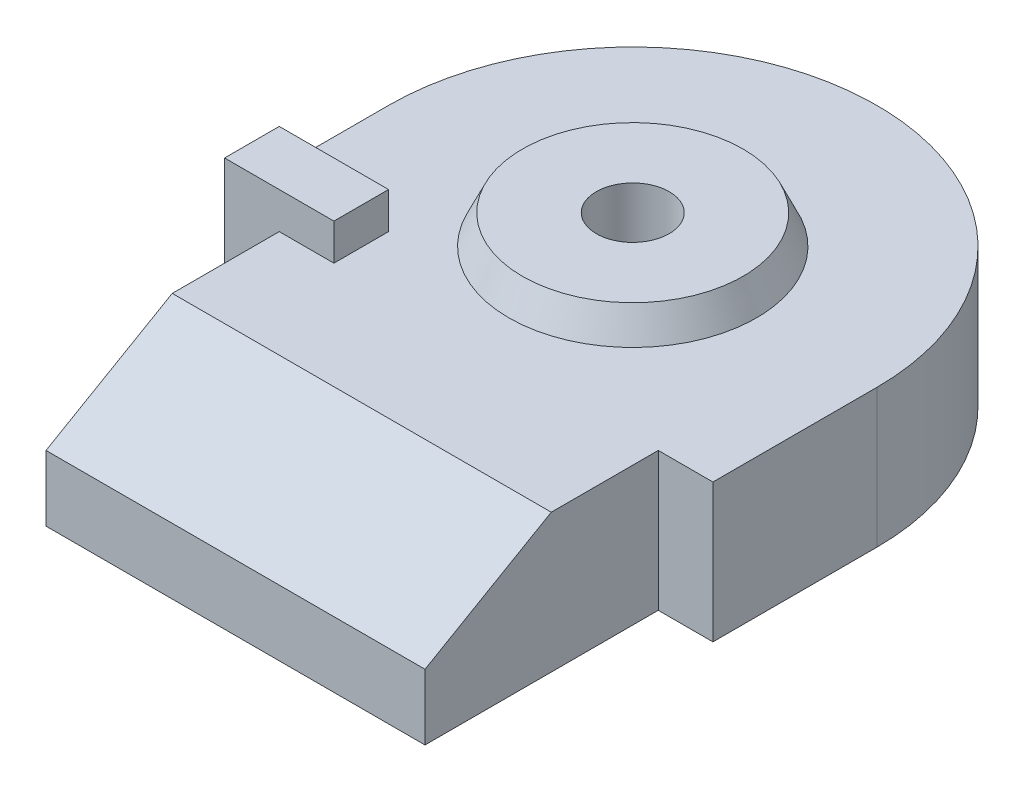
SolidWorks part; units mm, degrees
ref_plane "Front Plane" through (0, 0, 0) normal (0, 0, 1) x (1, 0, 0)
ref_plane "Top Plane" through (0, 0, 0) normal (0, 1, 0) x (1, 0, 0)
ref_plane "Right Plane" through (0, 0, 0) normal (1, 0, 0) x (0, 0, -1)
sketch "Sketch1" plane through (0, 0, 0) normal (0, 1, 0) x (1, 0, 0)
  line L0 (0, 335) -> (0, -545) construction
  line L1 (335, 0) -> (-335, 0) construction
  line L2 (-335, 0) -> (-335, -225)
  line L3 (-335, -225) -> (-260, -225)
  line L4 (-260, -225) -> (-260, -545)
  line L5 (-260, -545) -> (260, -545)
  line L6 (260, -225) -> (260, -545)
  line L7 (335, -225) -> (260, -225)
  line L8 (335, 0) -> (335, -225)
  arc A0 (335, 0) -> (-335, 0) centre (0, 0) ccw
  dimension "D1" = 75
  dimension "A" = 335
  dimension "B" = 545
  dimension "C" = 320
extrude "Boss-Extrude1" add sketch "Sketch1" along normal blind 190
sketch "Sketch3" plane through (0, 190, 0) normal (0, 1, 0) x (1, 0, 0)
  line L1 (-335, -225) -> (-185, -225)
  line L2 (-335, -225) -> (-335, -150)
  line L3 (-335, -150) -> (-185, -150)
  line L4 (-185, -225) -> (-185, -150)
  dimension "D1" = 75
  dimension "D2" = 150
extrude "Boss-Extrude2" add sketch "Sketch3" along normal blind 50
sketch "Sketch4" plane through (0, 0, 0) normal (0, 1, 0) x (1, 0, 0)
  circle A0 centre (0, 0) radius 50
  dimension "D1" = 100
extrude "Cut-Extrude2" cut sketch "Sketch4" along normal through all
sketch "Sketch5" plane through (0, 0, 0) normal (1, 0, 0) x (0, 0, -1)
  line L0 (-545, 0) -> (-545, 90) construction
  line L1 (-545, 190) -> (-545, 0) construction
  line L2 (-545, 90) -> (-371.7949, 190)
  line L3 (-545, 90) -> (-545, 275.8661) construction
  line L4 (-225, 190) -> (-545, 190) construction
  line L5 (-371.7949, 190) -> (-371.7949, 225.119)
  line L6 (-371.7949, 225.119) -> (-545, 225.119)
  dimension "D1" = 90
  dimension "D2" = 60
extrude "Cut-Extrude3" cut sketch "Sketch5" against normal through all and the other way through all
sketch "Sketch6" plane through (0, 0, 0) normal (1, 0, 0) x (0, 0, -1)
  line L0 (0, 0) -> (0, 339.6624) construction
  line L1 (170, 190) -> (151.3477, 230)
  line L2 (335, 190) -> (0, 190) construction
  line L3 (170, 190) -> (50, 190)
  line L4 (50, 190) -> (50, 230)
  line L5 (50, 230) -> (151.3477, 230)
  dimension "D1" = 170
  dimension "D2" = 40
  dimension "D3" = 65
revolve "Revolve1" add sketch "Sketch6" angle 360 about L0
equation "\"A\"=335.000000"
equation "\"B\"=545"
equation "\"C\"=320"
